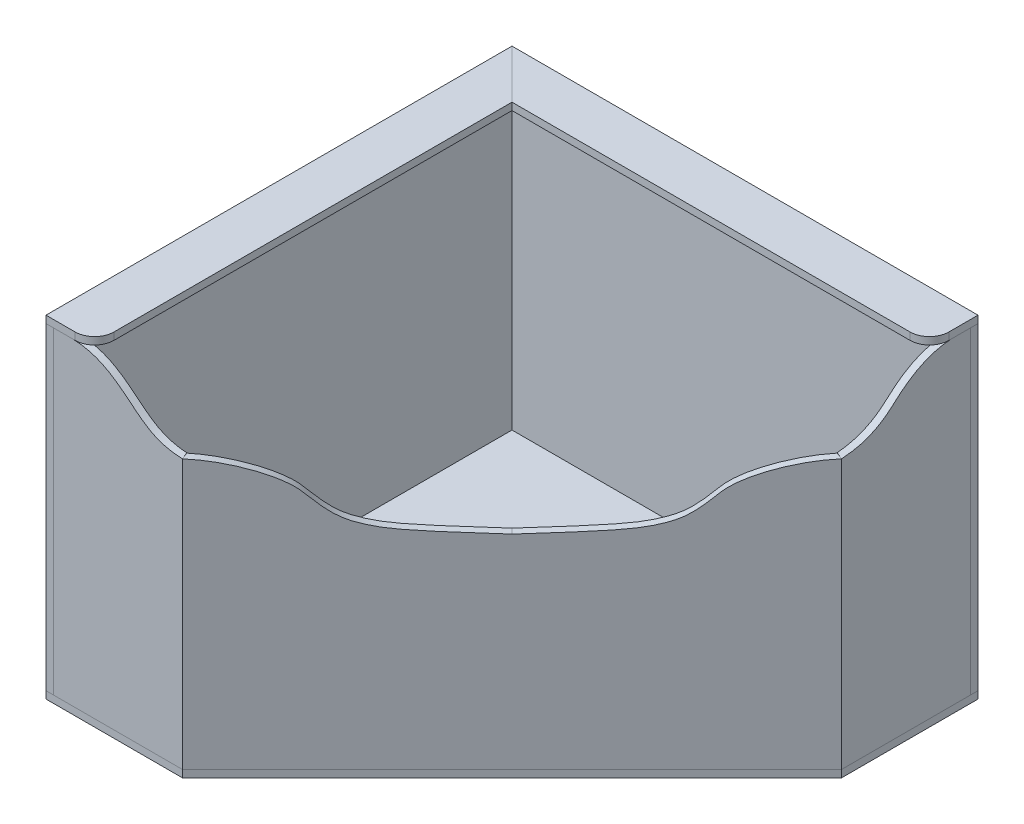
SolidWorks part; units mm, degrees
other "Camera1"
ref_plane "Front Plane" through (0, 0, 0) normal (0, 0, 1) x (1, 0, 0)
ref_plane "Top Plane" through (0, 0, 0) normal (0, 1, 0) x (1, 0, 0)
ref_plane "Right Plane" through (0, 0, 0) normal (1, 0, 0) x (0, 0, -1)
sketch "Sketch1" plane through (0, 0, 0) normal (0, 1, 0) x (1, 0, 0)
  line L1 (0, 0) -> (19.05, 0)
  line L2 (0, 0) -> (0, 1219.2)
  line L3 (0, 1219.2) -> (19.05, 1219.2)
  line L4 (19.05, 0) -> (19.05, 1219.2)
  dimension "D1" = 19.05
  dimension "D2" = 1219.2
extrude "Boss-Extrude1" add sketch "Sketch1" along normal blind 831.85
sketch "Sketch2" plane through (0, 0, 0) normal (0, 1, 0) x (1, 0, 0)
  line L1 (19.05, 1219.2) -> (1219.2, 1219.2)
  line L2 (19.05, 1219.2) -> (19.05, 1200.15)
  line L3 (19.05, 1200.15) -> (1219.2, 1200.15)
  line L4 (1219.2, 1219.2) -> (1219.2, 1200.15)
  dimension "D1" = 19.05
  dimension "D2" = 1200.15
extrude "Boss-Extrude2" add sketch "Sketch2" along normal blind 831.85 separate body
sketch "Sketch3" plane through (0, 0, 0) normal (0, 1, 0) x (1, 0, 0)
  line L0 (1219.2, 862.0592) -> (357.1408, 0) construction
  line L1 (19.05, 0) -> (357.1408, 0)
  line L2 (19.05, 0) -> (19.05, 19.05)
  line L3 (19.05, 19.05) -> (349.25, 19.05)
  line L4 (357.1408, 0) -> (349.25, 19.05)
  line L5 (1219.2, 1200.15) -> (1200.15, 1200.15)
  line L6 (1219.2, 1200.15) -> (1219.2, 862.0592)
  line L7 (1219.2, 862.0592) -> (1200.15, 869.95)
  line L8 (1200.15, 1200.15) -> (1200.15, 869.95)
  line L9 (349.25, 19.05) -> (1200.15, 869.95) construction
  dimension "D1" = 19.05
  dimension "D2" = 19.05
  dimension "D3" = 330.2
  dimension "D4" = 330.2
  dimension "D5" = 67.5
  dimension "D6" = 67.5
extrude "Boss-Extrude3" add sketch "Sketch3" along normal blind 831.85 separate body
sketch "Sketch5" plane through (0, 0, 0) normal (0, -1, 0) x (1, 0, 0)
  line L0 (0, 0) -> (357.1408, 0)
  line L1 (357.1408, 0) -> (1219.2, -862.0592)
  line L2 (1219.2, -862.0592) -> (1219.2, -1219.2)
  line L3 (1219.2, -1219.2) -> (0, -1219.2)
  line L4 (0, -1219.2) -> (0, 0)
  line L5 (285.75, -260.35) -> (285.75, 0) construction
  circle A0 centre (285.75, -260.35) radius 39.6875
  dimension "D2" = 79.375
  dimension "D1" = 285.75
  dimension "D3" = 260.35
extrude "Boss-Extrude5" add sketch "Sketch5" along normal blind 19.05 separate body
sketch "Sketch6" plane through (0, 0, 0) normal (0, 1, 0) x (1, 0, 0)
  circle A0 centre (285.75, 260.35) radius 53.975
  circle A4 centre (285.75, 260.35) radius 39.6875 construction
  dimension "D1" = 107.95
extrude "Cut-Extrude1" cut sketch "Sketch6" against normal blind 3.175
sketch "Sketch23" plane through (178.5704, 0, 178.5704) normal (0.7071, 0, 0.7071) x (0.7071, 0, -0.7071)
  line L0 (1471.6725, 533.4) -> (252.5367, 533.4) construction
  line L3 (862.1046, 533.4) -> (862.1046, 0) construction
  line L4 (1471.6725, 0) -> (252.5367, 0) construction
  line L11 (1471.6725, 831.85) -> (1471.6725, 0) construction
  line L12 (252.5367, 831.85) -> (252.5367, 0) construction
  spline S0 degree 3 poles (862.1046, 533.4) (1032.8698, 539.9136) (1091.716, 544.5165) (1167.8357, 564.7194) (1201.5344, 581.4759) (1283.5017, 665.0345) (1399.0763, 700.7421) (1471.6725, 703.8157) knots 0 0 0 0 0.332635 0.40635 0.700396 0.763437 1 1 1 1
  spline S1 degree 3 poles (862.1046, 533.4) (691.3394, 539.9136) (632.4931, 544.5165) (556.3734, 564.7194) (522.6748, 581.4759) (440.7074, 665.0345) (325.1329, 700.7421) (252.5367, 703.8157) knots 0 0 0 0 0.332635 0.40635 0.700396 0.763437 1 1 1 1
  dimension "D1" = 533.4
surface "Surface-Extrude3" sketch "Sketch23" parameters "D1"=25.4, "D3"=0
sketch "Sketch24" plane through (0, 0, 0) normal (0, 1, 0) x (1, 0, 0)
  line L0 (357.1408, 0) -> (349.2498, 19.0498)
  line L1 (349.2498, 19.0498) -> (1200.15, 869.95)
  line L2 (1200.15, 869.95) -> (1219.2, 862.0592)
  line L3 (1219.2, 862.0592) -> (357.1408, 0)
  line L4 (788.1704, 431.0296) -> (655.0283, 564.1717) construction
extrude "Boss-Extrude11" add sketch "Sketch24" along normal up to surface (703.8157 mm away) separate body
sketch "Sketch25" plane through (1219.2, 0, 0) normal (1, 0, 0) x (0, 0, -1)
  line L0 (862.0592, 831.85) -> (1200.15, 831.85) construction
  line L1 (1149.35, 831.85) -> (1200.15, 831.85)
  line L2 (862.0592, 703.8157) -> (862.0592, 831.85)
  line L3 (862.0592, 831.85) -> (1149.35, 831.85)
  line L4 (950.1972, 726.186) -> (950.1972, 831.85) construction
  line L5 (950.1972, 726.186) -> (862.0592, 726.186) construction
  line L6 (1023.8572, 781.812) -> (1023.8572, 831.85) construction
  spline S0 degree 3 poles (862.0592, 703.8157) (886.7971, 705.6574) (920.4878, 710.3079) (987.5413, 745.8946) (1005.6705, 773.9217) (1092.2232, 828.8457) (1149.35, 831.85) knots 0 0 0 0 0.275879 0.34347 0.67591 1 1 1 1
  dimension "D1" = 50.8
  dimension "D2" = 88.138
  dimension "D3" = 105.664
  dimension "D4" = 50.038
  dimension "D5" = 73.66
extrude "Cut-Extrude2" cut sketch "Sketch25" against normal blind 25.4 contours S0 M5 M4
sketch "Sketch26" plane through (0, 0, 0) normal (0, 0, 1) x (1, 0, 0)
  line L0 (19.05, 831.85) -> (69.85, 831.85)
  line L1 (19.05, 831.85) -> (357.1408, 831.85) construction
  line L2 (197.973, 781.812) -> (197.973, 831.85) construction
  line L3 (271.633, 726.186) -> (271.633, 831.85) construction
  line L4 (357.1408, 831.85) -> (357.1408, 0) construction
  line L5 (69.85, 831.85) -> (357.1408, 831.85)
  line L6 (357.1408, 831.85) -> (357.1408, 703.8157)
  spline S0 degree 3 poles (69.85, 831.85) (122.6495, 830.6746) (187.1711, 796.0892) (269.82, 718.711) (322.7824, 705.2725) (357.1408, 703.8157) knots 0 0 0 0 0.428785 0.71653 1 1 1 1
  dimension "D1" = 50.8
  dimension "D2" = 50.038
  dimension "D3" = 105.664
  dimension "D4" = 73.66
  dimension "D5" = 85.5077
extrude "Cut-Extrude3" cut sketch "Sketch26" against normal blind 25.4 contours S0 M6 M5
sketch "Sketch27" plane through (0, 831.85, 0) normal (0, 1, 0) x (1, 0, 0)
  line L0 (0, 1219.2) -> (127, 1092.2)
  line L1 (127, 1092.2) -> (1168.4, 1092.2)
  line L2 (0, 1219.2) -> (1219.2, 1219.2)
  line L3 (1219.2, 1143) -> (1219.2, 1219.2)
  arc A0 (1168.4, 1092.2) -> (1219.2, 1143) centre (1168.4, 1143) ccw
  dimension "D3" = 50.8
  dimension "D1" = 45
  dimension "D2" = 127
extrude "Boss-Extrude12" add sketch "Sketch27" along normal blind 19.05 separate body
sketch "Sketch28" plane through (0, 831.85, 0) normal (0, 1, 0) x (1, 0, 0)
  line L0 (0, 0) -> (0, 1219.2)
  line L1 (0, 1219.2) -> (127, 1092.2)
  line L2 (127, 1092.2) -> (127, 50.8)
  line L3 (76.2, 0) -> (0, 0)
  arc A0 (127, 50.8) -> (76.2, 0) centre (76.2, 50.8) cw
  dimension "D1" = 50.8
extrude "Boss-Extrude13" add sketch "Sketch28" along normal blind 19.05 separate body
